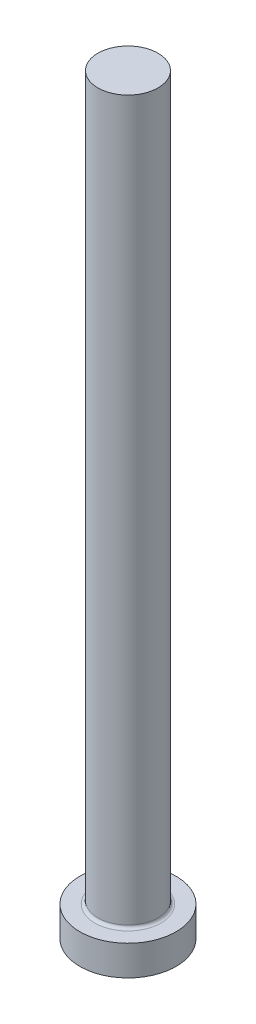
SolidWorks part; units mm, degrees
ref_plane "Plano frontal" through (0, 0, 0) normal (0, 0, 1) x (1, 0, 0)
ref_plane "Plano superior" through (0, 0, 0) normal (0, 1, 0) x (1, 0, 0)
ref_plane "Plano direito" through (0, 0, 0) normal (1, 0, 0) x (0, 0, -1)
sketch "Esboço1" plane through (0, 0, 0) normal (0, 0, 1) x (1, 0, 0)
  line L0 (0, 0) -> (8, 0)
  line L1 (8, 0) -> (8, 5)
  line L2 (8, 5) -> (5.5, 5)
  line L3 (5, 5.5) -> (5, 125)
  line L4 (5, 125) -> (0, 125)
  line L5 (0, 125) -> (0, 0) construction
  line L6 (0, 0) -> (0, 125)
  arc A0 (5.5, 5) -> (5, 5.5) centre (5.5, 5.5) cw
  dimension "D3" = 0.5
  dimension "D1" = 16
  dimension "D2" = 10
  dimension "D4" = 5
  dimension "D5" = 125
revolve "Revolução1" add sketch "Esboço1" angle 360 about L5
sketch "Esboço2"
  dimension "D1" = 0.9
  dimension "D2" = 1.4
  dimension "D3" = 4.3
  dimension "D4" = 0.6
wrap "Envolver1" sketch "Esboço2" wrap type deboss source sketch "Esboço2" thickness 0.1 parameters "D1"=0.1
